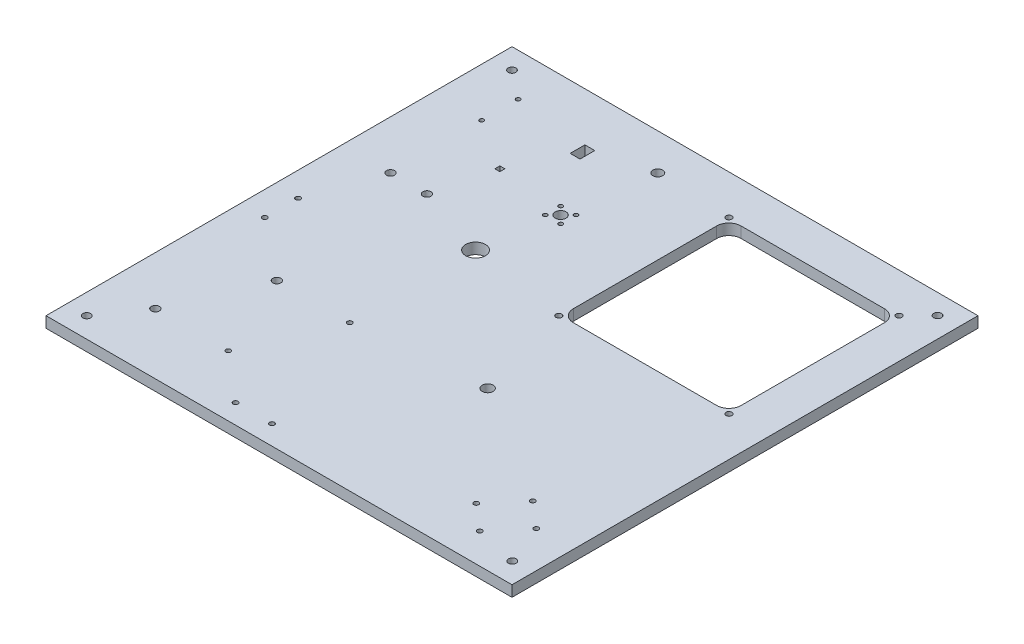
SolidWorks part; units mm, degrees
ref_plane "Front Plane" through (0, 0, 0) normal (0, 0, 1) x (1, 0, 0)
ref_plane "Top Plane" through (0, 0, 0) normal (0, 1, 0) x (1, 0, 0)
ref_plane "Right Plane" through (0, 0, 0) normal (1, 0, 0) x (0, 0, -1)
sketch "Sketch2" plane through (0, 0, 0) normal (0, 1, 0) x (1, 0, 0)
  line L1 (-191.77, -191.77) -> (191.77, -191.77)
  line L2 (-191.77, -191.77) -> (-191.77, 191.77)
  line L3 (-191.77, 191.77) -> (191.77, 191.77)
  line L4 (191.77, -191.77) -> (191.77, 191.77)
  line L5 (-191.77, -191.77) -> (191.77, 191.77) construction
  line L6 (-191.77, 191.77) -> (191.77, -191.77) construction
  point P0 (0, 0)
  dimension "D1" = 383.54
  dimension "D2" = 383.54
extrude "Boss-Extrude2" add sketch "Sketch2" along normal blind 8.9916
hole_wizard "M6 Clearance Hole3" positions "Sketch3" profile "Sketch4" hole size "M6" standard "ANSI Metric"
sketch "Sketch3" plane through (0, 8.9916, 0) normal (0, 1, 0) x (1, 0, 0)
  line L0 (191.77, 191.77) -> (-191.77, 191.77) construction
  line L1 (191.77, -191.77) -> (191.77, 191.77) construction
  point P0 (51.77, 151.77)
  point P2 (151.77, 151.77)
  point P4 (101.77, 101.77)
  point P6 (51.77, 51.77)
  point P8 (76.77, 76.77)
  point P10 (101.77, 51.77)
  dimension "D1" = 40
  dimension "D2" = 140
  dimension "D3" = 40
  dimension "D4" = 100
  dimension "D5" = 50
  dimension "D6" = 50
  dimension "D7" = 50
  dimension "D8" = 50
  dimension "D9" = 50
  dimension "D10" = 25
  dimension "D11" = 25
  dimension "D12" = 140
sketch "Sketch4" plane through (51.77, 8.9916, -151.77) normal (1, 0, 0) x (0, 0, 1)
  line L0 (0, 0) -> (0, 8.9916)
  line L1 (0, 8.9916) -> (3.3, 8.9916)
  line L2 (3.3, 8.9916) -> (3.3, 0)
  line L5 (3.3, 0) -> (0, 0)
  line L11 (0, -6.35) -> (0, 107.95) construction
  dimension "Thru Hole Dia." = 6.6
  dimension "Thru Hole Depth" = 8.9916
hole_wizard "M8 Clearance Hole2" positions "Sketch5" profile "Sketch6" hole size "M8" standard "ANSI Metric"
sketch "Sketch5" plane through (0, 8.9916, 0) normal (0, 1, 0) x (1, 0, 0)
  circle A1 centre (151.77, 151.77) radius 3.3 construction
  circle A2 centre (51.77, 151.77) radius 3.3 construction
  circle A3 centre (76.77, 76.77) radius 3.3 construction
  circle A4 centre (101.77, 101.77) radius 3.3 construction
  point P0 (126.77, 126.77)
  point P2 (26.77, 126.77)
  point P4 (151.77, 101.77)
  point P6 (126.77, 26.77)
  point P8 (76.77, 26.77)
  point P10 (26.77, 76.77)
  dimension "D11" = 50
  dimension "D1" = 25
  dimension "D2" = 25
  dimension "D3" = 75
  dimension "D4" = 50
  dimension "D5" = 50
  dimension "D6" = 50
  dimension "D7" = 75
  dimension "D8" = 50
  dimension "D9" = 50
  dimension "D10" = 50
  dimension "D12" = 50
sketch "Sketch6" plane through (126.77, 8.9916, -126.77) normal (1, 0, 0) x (0, 0, 1)
  line L0 (0, 0) -> (0, 8.9916)
  line L1 (0, 8.9916) -> (5, 8.9916)
  line L2 (5, 8.9916) -> (5, 0)
  line L5 (5, 0) -> (0, 0)
  line L11 (0, -6.35) -> (0, 107.95) construction
  dimension "Thru Hole Dia." = 10
  dimension "Thru Hole Depth" = 8.9916
hole_wizard "1/4 (0.2500) Dowel Hole1" positions "Sketch9" profile "Sketch10" hole size "1/4" standard "ANSI Inch"
sketch "Sketch9" plane through (0, 8.9916, 0) normal (0, 1, 0) x (1, 0, 0)
  line L1 (-191.77, -191.77) -> (191.77, -191.77) construction
  line L10 (191.77, -191.77) -> (191.77, 191.77) construction
  line L11 (191.77, 191.77) -> (-191.77, 191.77) construction
  point P0 (-175, -175)
  point P2 (-175, 175)
  point P4 (175, 175.23)
  point P6 (175, -174.77)
  dimension "D1" = 350
  dimension "D2" = 350
  dimension "D3" = 350
  dimension "D4" = 350
  dimension "D5" = 16.77
  dimension "D6" = 16.77
  dimension "D7" = 16.77
sketch "Sketch10" plane through (-175, 8.9916, 175) normal (1, 0, 0) x (0, 0, 1)
  line L0 (0, 0) -> (0, 8.9916)
  line L1 (0, 8.9916) -> (3.175, 8.9916)
  line L2 (3.175, 8.9916) -> (3.175, 0)
  line L5 (3.175, 0) -> (0, 0)
  line L11 (0, -6.35) -> (0, 107.95) construction
  dimension "Thru Hole Dia." = 6.35
  dimension "Thru Hole Depth" = 8.9916
hole_wizard "Ø4.0mm Dowel Hole1" positions "Sketch11" profile "Sketch12" hole size "Ø4.0" standard "ANSI Metric"
sketch "Sketch11" plane through (0, 8.9916, 0) normal (0, 1, 0) x (1, 0, 0)
  line L0 (-191.77, -191.77) -> (191.77, -191.77) construction
  line L1 (-191.77, 191.77) -> (-191.77, -191.77) construction
  line L2 (191.77, -191.77) -> (191.77, 191.77) construction
  point P0 (-51.77, -175.77)
  point P2 (-21.77, -175.77)
  point P4 (-91.77, -141.77)
  point P6 (-61.77, -71.77)
  point P24 (-171.77, -31.77)
  point P26 (-171.77, -4.338)
  point P71 (140.2293, -166.77)
  point P72 (161.77, -141.77)
  point P73 (140.5778, -123.47)
  point P74 (119.0371, -148.47)
  dimension "D1" = 30
  dimension "D2" = 16
  dimension "D3" = 50
  dimension "D4" = 100
  dimension "D5" = 130
  dimension "D6" = 120
  dimension "D7" = 27.432
  dimension "D8" = 20
  dimension "D9" = 160
  dimension "D10" = 33
  dimension "D11" = 50
  dimension "D12" = 68.3
  dimension "D13" = 33
  dimension "D14" = 28
  dimension "D15" = 28
  dimension "D16" = 30
  dimension "D17" = 25
  dimension "D18" = 140
sketch "Sketch12" plane through (-51.77, 8.9916, 175.77) normal (1, 0, 0) x (0, 0, 1)
  line L0 (0, 0) -> (0, 10.1917)
  line L1 (0, 10.1917) -> (2, 8.99)
  line L2 (2, 8.99) -> (2, 0)
  line L5 (2, 0) -> (0, 0)
  line L10 (0, 10.1917) -> (-2, 8.99) construction
  line L11 (0, -6.35) -> (0, 107.95) construction
  dimension "Hole Dia." = 4
  dimension "Hole Depth" = 8.99
  dimension "Drill Angle" = 118
hole_wizard "M6 Clearance Hole2" positions "Sketch13" profile "Sketch14" hole size "M6" standard "ANSI Metric"
sketch "Sketch13" plane through (0, 8.9916, 0) normal (0, 1, 0) x (1, 0, 0)
  line L0 (-191.77, 191.77) -> (-191.77, -191.77) construction
  line L1 (191.77, 191.77) -> (-191.77, 191.77) construction
  line L2 (-191.77, -191.77) -> (191.77, -191.77) construction
  circle A2 centre (-61.77, -71.77) radius 2 construction
  circle A3 centre (-91.77, -141.77) radius 2 construction
  point P0 (-151.77, -141.77)
  point P2 (-121.77, -71.77)
  point P4 (-151.77, 51.77)
  point P6 (-121.77, 51.77)
  dimension "D5" = 60
  dimension "D1" = 30
  dimension "D2" = 40
  dimension "D3" = 140
  dimension "D4" = 60
  dimension "D6" = 120
  dimension "D7" = 50
sketch "Sketch14" plane through (-151.77, 8.9916, 141.77) normal (1, 0, 0) x (0, 0, 1)
  line L0 (0, 0) -> (0, 10.9728)
  line L1 (0, 10.9728) -> (3.3, 8.99)
  line L2 (3.3, 8.99) -> (3.3, 0)
  line L5 (3.3, 0) -> (0, 0)
  line L10 (0, 10.9728) -> (-3.3, 8.99) construction
  line L11 (0, -6.35) -> (0, 107.95) construction
  dimension "Hole Dia." = 6.6
  dimension "Hole Depth" = 8.99
  dimension "Drill Angle" = 118
hole_wizard "M8 Clearance Hole1" positions "Sketch15" profile "Sketch16" hole size "M8" standard "ANSI Metric"
sketch "Sketch15" plane through (0, 8.9916, 0) normal (0, 1, 0) x (1, 0, 0)
  line L0 (191.77, -191.77) -> (191.77, 191.77) construction
  line L1 (-191.77, -191.77) -> (191.77, -191.77) construction
  point P0 (41.77, -61.77)
  dimension "D1" = 150
  dimension "D2" = 130
sketch "Sketch16" plane through (41.77, 8.9916, 61.77) normal (1, 0, 0) x (0, 0, 1)
  line L0 (0, 0) -> (0, 11.6939)
  line L1 (0, 11.6939) -> (4.5, 8.99)
  line L2 (4.5, 8.99) -> (4.5, 0)
  line L5 (4.5, 0) -> (0, 0)
  line L10 (0, 11.6939) -> (-4.5, 8.99) construction
  line L11 (0, -6.35) -> (0, 107.95) construction
  dimension "Hole Dia." = 9
  dimension "Hole Depth" = 8.99
  dimension "Drill Angle" = 118
hole_wizard "M3 Clearance Hole1" positions "Sketch17" profile "Sketch18" hole size "M3" standard "ANSI Metric"
sketch "Sketch17" plane through (0, 8.9916, 0) normal (0, 1, 0) x (1, 0, 0)
  line L0 (-191.77, 191.77) -> (-191.77, -191.77) construction
  line L1 (191.77, 191.77) -> (-191.77, 191.77) construction
  point P0 (-151.77, 156.77)
  point P2 (-151.77, 126.77)
  point P4 (-58.09, 85.44)
  point P6 (-45.44, 85.44)
  point P8 (-45.44, 98.09)
  point P10 (-58.09, 98.09)
  dimension "D1" = 30
  dimension "D2" = 12.65
  dimension "D3" = 12.65
  dimension "D4" = 12.65
  dimension "D5" = 12.65
  dimension "D6" = 17.8898
  dimension "D7" = 40
  dimension "D8" = 35
  dimension "D9" = 40
  dimension "D10" = 133.68
  dimension "D11" = 93.68
sketch "Sketch18" plane through (-151.77, 8.9916, -156.77) normal (1, 0, 0) x (0, 0, 1)
  line L0 (0, 0) -> (0, 10.0115)
  line L1 (0, 10.0115) -> (1.7, 8.99)
  line L2 (1.7, 8.99) -> (1.7, 0)
  line L5 (1.7, 0) -> (0, 0)
  line L10 (0, 10.0115) -> (-1.7, 8.99) construction
  line L11 (0, -6.35) -> (0, 107.95) construction
  dimension "Hole Dia." = 3.4
  dimension "Hole Depth" = 8.99
  dimension "Drill Angle" = 118
sketch "Sketch19" plane through (0, 8.9916, 0) normal (0, 1, 0) x (1, 0, 0)
  line L0 (-91.77, 151.77) -> (-91.77, 139.63)
  line L1 (-91.77, 139.63) -> (-83.65, 139.63)
  line L2 (-83.65, 139.63) -> (-83.65, 151.77)
  line L3 (-83.65, 151.77) -> (-91.77, 151.77)
  line L4 (-111.77, 101.77) -> (-111.77, 97.65)
  line L5 (-111.77, 97.65) -> (-107.65, 97.65)
  line L6 (-107.65, 97.65) -> (-107.65, 101.77)
  line L7 (-107.65, 101.77) -> (-111.77, 101.77)
  line L8 (191.77, 191.77) -> (-191.77, 191.77) construction
  line L9 (-191.77, 191.77) -> (-191.77, -191.77) construction
  circle A0 centre (-61.77, 31.77) radius 8.1
  circle A1 centre (-41.77, 161.77) radius 4.06
  circle A2 centre (-51.77, 91.77) radius 4.5
  dimension "D1" = 4.12
  dimension "D13" = 100
  dimension "D2" = 4.12
  dimension "D3" = 8.12
  dimension "D4" = 12.14
  dimension "D5" = 40
  dimension "D6" = 100
  dimension "D7" = 90
  dimension "D8" = 80
  dimension "D9" = 130
  dimension "D10" = 160
  dimension "D11" = 30
  dimension "D12" = 150
  dimension "D14" = 140
extrude "Cut-Extrude1" cut sketch "Sketch19" against normal through all
sketch "Sketch20" plane through (0, 8.9916, 0) normal (0, 1, 0) x (1, 0, 0)
  circle A0 centre (151.77, 151.77) radius 3.3 construction
  point P0 (159.27, 159.27)
  point P1 (159.27, 19.27)
  point P2 (19.27, 19.27)
  point P3 (19.27, 159.27)
  dimension "D3" = 140
  dimension "D1" = 7.5
  dimension "D2" = 7.5
  dimension "D4" = 140
hole_wizard "M4 Clearance Hole1" positions "Sketch21" profile "Sketch22" hole size "M4" standard "ANSI Metric"
sketch "Sketch21" plane through (0, 8.9916, 0) normal (0, 1, 0) x (1, 0, 0)
  point P0 (159.27, 159.27)
  point P3 (19.27, 159.27)
  point P6 (19.27, 19.27)
  point P9 (159.27, 19.27)
sketch "Sketch22" plane through (159.27, 8.9916, -159.27) normal (1, 0, 0) x (0, 0, 1)
  line L0 (0, 0) -> (0, 8.9916)
  line L1 (0, 8.9916) -> (2.4, 8.9916)
  line L2 (2.4, 8.9916) -> (2.4, 0)
  line L5 (2.4, 0) -> (0, 0)
  line L11 (0, -6.35) -> (0, 107.95) construction
  dimension "Thru Hole Dia." = 4.8
  dimension "Thru Hole Depth" = 8.9916
sketch "Sketch23" plane through (0, 8.9916, 0) normal (0, 1, 0) x (1, 0, 0)
  line L1 (30.25, 20.25) -> (148.25, 20.25)
  line L2 (20.25, 30.25) -> (20.25, 148.25)
  line L3 (30.25, 158.25) -> (148.25, 158.25)
  line L4 (158.25, 30.25) -> (158.25, 148.25)
  line L6 (-4.9454, 0) -> (4.9454, 0) construction
  line L8 (0, -4.9454) -> (0, 4.9454) construction
  arc A0 (20.25, 148.25) -> (30.25, 158.25) centre (30.25, 148.25) cw
  arc A1 (30.25, 20.25) -> (20.25, 30.25) centre (30.25, 30.25) cw
  arc A2 (158.25, 30.25) -> (148.25, 20.25) centre (148.25, 30.25) cw
  arc A3 (148.25, 158.25) -> (158.25, 148.25) centre (148.25, 148.25) cw
  point P10 (20.25, 158.25)
  point P15 (158.25, 20.25)
  point P18 (158.25, 158.25)
  dimension "D5" = 10
  dimension "D6" = 10
  dimension "D7" = 10
  dimension "D8" = 10
  dimension "D1" = 138
  dimension "D2" = 138
  dimension "D3" = 20.25
  dimension "D4" = 20.25
extrude "Cut-Extrude2" cut sketch "Sketch23" against normal through all
